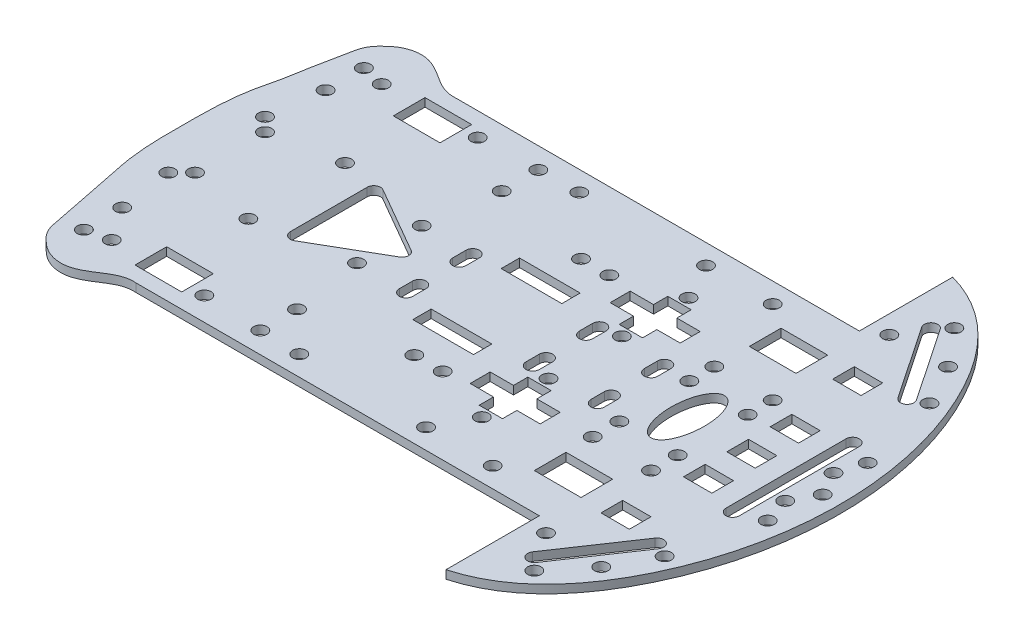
SolidWorks part; units mm, degrees
ref_plane "Front Plane" through (0, 0, 0) normal (0, 0, 1) x (1, 0, 0)
ref_plane "Top Plane" through (0, 0, 0) normal (0, 1, 0) x (1, 0, 0)
ref_plane "Right Plane" through (0, 0, 0) normal (1, 0, 0) x (0, 0, -1)
sketch "Sketch2" plane through (0, 0, 0) normal (0, 1, 0) x (1, 0, 0)
  line L0 (0, 0) -> (0, 28)
  line L1 (0, 0) -> (-121, 0)
  line L2 (0, 0) -> (0, -124) construction
  line L3 (0, -124) -> (0, -96)
  line L4 (14, 21) -> (14, -117) construction
  line L5 (32, -2.5) -> (32, -93.5) construction
  line L6 (0, -96) -> (-121, -96)
  line L7 (-254.3121, -48) -> (180.1863, -48) construction
  line L8 (0, 0) -> (-155, 0) construction
  line L9 (0, -96) -> (-122.5501, -96) construction
  line L10 (-155, 48.2014) -> (-155, -143.5437) construction
  line L11 (-148, -96) -> (-155, -96) construction
  spline S0 degree 3 poles (0, 28) (15.1894, 23.8115) (45.5362, -13.3174) (45.5362, -82.6826) (15.1894, -119.8115) (0, -124) knots 0 0 0 0 0.249322 0.750678 1 1 1 1
  spline S1 degree 3 poles (-121, 0) (-125.0399, -0.3556) (-129.1896, 3.3273) (-135.1577, 6.1602) (-139.4539, 6.1499) (-143.9567, 4.43) (-146.3978, 1.5367) (-148, 0) knots 0 0 0 0 0.360479 0.538086 0.637028 0.777922 1 1 1 1
  spline S2 degree 3 poles (-121, -96) (-125.0399, -95.6444) (-129.1896, -99.3273) (-135.1577, -102.1602) (-139.4539, -102.1499) (-143.9567, -100.43) (-146.3978, -97.5367) (-148, -96) knots 0 0 0 0 0.360479 0.538086 0.637028 0.777922 1 1 1 1
  spline S3 degree 3 poles (-148, 0) (-148.6873, -3.3293) (-149.6255, -8.3415) (-151.1154, -15.2359) (-151.7943, -20.3008) (-153.102, -25.2346) (-154.9359, -34.2214) (-155.0201, -47.9932) (-155.0126, -61.796) (-152.9783, -70.9972) (-152.0058, -76.0008) (-150.9985, -80.9998) (-149.6677, -87.6668) (-148.6662, -92.6666) (-148, -96) knots 0 0 0 0 0.104866 0.157299 0.217562 0.262212 0.314645 0.500024 0.685402 0.737835 0.790268 0.842701 0.895134 1 1 1 1
  point P18 (-126, 1)
  point P20 (-131, 4)
  point P23 (-136, 6)
  point P24 (-139, 6)
  point P25 (-143, 4.5)
  point P26 (-146, 2)
  point P28 (-148, 0)
  point P42 (-149, -91)
  point P43 (-150, -86)
  point P44 (-151, -81)
  point P45 (-152, -76)
  point P46 (-153, -71)
  point P47 (-154, -66)
  point P48 (-154, -30)
  point P49 (30.7503, -96)
  point P50 (-153, -25)
  point P51 (-152, -20)
  point P52 (-151, -15)
  point P53 (-150, -10)
  point P54 (-149, -5)
  dimension "D1" = 28
  dimension "D2" = 124
  dimension "D3" = 5
  dimension "D4" = 14
  dimension "D5" = 18
  dimension "D6" = 48
  dimension "D7" = 69
  dimension "D8" = 69
  dimension "D9" = 45.5
  dimension "D10" = 45.5
  dimension "D11" = 155
  dimension "D12" = 155
  dimension "D13" = 34
  dimension "D14" = 5
  dimension "D15" = 1
  dimension "D16" = 4
  dimension "D17" = 10
  dimension "D18" = 15
  dimension "D19" = 18
  dimension "D20" = 22
  dimension "D21" = 25
  dimension "D22" = 6
  dimension "D23" = 6
  dimension "D24" = 4.5
  dimension "D25" = 2
  dimension "D26" = 27
  dimension "D27" = 10
  dimension "D28" = 15
  dimension "D29" = 20
  dimension "D30" = 25
  dimension "D31" = 30
  dimension "D32" = 6
  dimension "D33" = 5
  dimension "D34" = 4
  dimension "D35" = 3
  dimension "D36" = 2
  dimension "D37" = 1
  dimension "D38" = 30.7503
extrude "Boss-Extrude1" add sketch "Sketch2" along normal blind 2.5
fillet "Fillet2" radius 9 2 edges at (-148, 1.25, 0) (-148, 1.25, 96)
sketch "Sketch3" plane through (0, 0, 0) normal (0, -1, 0) x (1, 0, 0)
  line L0 (-60.5, 96) -> (-60.5, 0) construction
  line L1 (-12.5, 85) -> (1.5, 85)
  line L2 (-12.5, 85) -> (-12.5, 75.5)
  line L3 (-12.5, 75.5) -> (1.5, 75.5)
  line L4 (1.5, 85) -> (1.5, 75.5)
  line L5 (-121, 96) -> (0, 96) construction
  line L6 (0, 0) -> (-121, 0) construction
  line L7 (-155, 48) -> (42.1522, 48) construction
  line L8 (0, 96) -> (0, 124) construction
  line L9 (10, 107.5) -> (24.8186, 85.5305) construction
  line L10 (8.5, 86) -> (17, 86)
  line L11 (8.5, 86) -> (8.5, 79.5)
  line L12 (8.5, 79.5) -> (17, 79.5)
  line L13 (17, 86) -> (17, 79.5)
  line L14 (11.6581, 108.6184) -> (26.4767, 86.6489)
  line L15 (8.3419, 106.3816) -> (23.1605, 84.4121)
  line L17 (17.4093, 96.5153) -> (35.1318, 108.4692) construction
  line L18 (28, 30) -> (28, 66) construction
  line L19 (26, 30) -> (26, 66)
  line L20 (30, 30) -> (30, 66)
  line L21 (11.5, 51.25) -> (20, 51.25)
  line L22 (11.5, 51.25) -> (11.5, 44.75)
  line L23 (11.5, 44.75) -> (20, 44.75)
  line L24 (20, 51.25) -> (20, 44.75)
  line L25 (11.5, 64.25) -> (20, 64.25)
  line L26 (11.5, 64.25) -> (11.5, 57.75)
  line L27 (11.5, 57.75) -> (20, 57.75)
  line L28 (20, 64.25) -> (20, 57.75)
  line L29 (-34.25, 96) -> (-34.25, 48) construction
  line L30 (-40, 58) -> (-40, 54) construction
  line L31 (-38, 58) -> (-38, 54)
  line L32 (-42, 58) -> (-42, 54)
  line L33 (-20.5, 58) -> (-20.5, 54) construction
  line L34 (-18.5, 58) -> (-18.5, 54)
  line L35 (-22.5, 58) -> (-22.5, 54)
  line L36 (-78, 58) -> (-78, 54) construction
  line L37 (-76, 58) -> (-76, 54)
  line L38 (-80, 58) -> (-80, 54)
  line L39 (-37.75, 66) -> (-37.75, 61.7)
  line L40 (-69.95, 64) -> (-51.75, 64)
  line L41 (-69.95, 64) -> (-69.95, 58.5)
  line L42 (-69.95, 58.5) -> (-51.75, 58.5)
  line L43 (-51.75, 64) -> (-51.75, 58.5)
  line L44 (-44.75, 72) -> (-37.75, 72)
  line L45 (-44.75, 72) -> (-44.75, 66)
  line L46 (-44.75, 66) -> (-37.75, 66)
  line L47 (-23.75, 72) -> (-23.75, 66)
  line L48 (-37.75, 76.3) -> (-30.75, 76.3)
  line L49 (-37.75, 76.3) -> (-37.75, 72)
  line L50 (-37.75, 61.7) -> (-30.75, 61.7)
  line L51 (-30.75, 76.3) -> (-30.75, 72)
  line L52 (-30.75, 66) -> (-30.75, 61.7)
  line L53 (-30.75, 72) -> (-23.75, 72)
  line L54 (-30.75, 66) -> (-23.75, 66)
  line L55 (-142.6374, 90) -> (-142.6374, 60.8786) construction
  line L56 (-125.8, 91.5) -> (-111.8, 91.5)
  line L57 (-125.8, 91.5) -> (-125.8, 82)
  line L58 (-125.8, 82) -> (-111.8, 82)
  line L59 (-111.8, 91.5) -> (-111.8, 82)
  line L60 (-23.75, 24) -> (-23.75, 30)
  line L67 (-111.1799, 59.5359) -> (-111.1799, 36.4641)
  line L68 (-108.1799, 34.7321) -> (-88.1991, 46.2679)
  line L69 (-88.1991, 49.7321) -> (-108.1799, 61.2679)
  line L70 (10, -11.5) -> (24.8186, 10.4695) construction
  line L71 (11.6581, -12.6184) -> (26.4767, 9.3511)
  line L72 (8.3419, -10.3816) -> (23.1605, 11.5879)
  line L73 (8.5, 10) -> (17, 10)
  line L74 (8.5, 10) -> (8.5, 16.5)
  line L75 (17, 10) -> (17, 16.5)
  line L76 (8.5, 16.5) -> (17, 16.5)
  line L77 (11.5, 38.25) -> (20, 38.25)
  line L78 (20, 31.75) -> (20, 38.25)
  line L79 (11.5, 31.75) -> (20, 31.75)
  line L80 (11.5, 31.75) -> (11.5, 38.25)
  line L81 (-20.5, 38) -> (-20.5, 42) construction
  line L82 (-18.5, 38) -> (-18.5, 42)
  line L83 (-22.5, 38) -> (-22.5, 42)
  line L84 (1.5, 11) -> (1.5, 20.5)
  line L85 (-12.5, 20.5) -> (1.5, 20.5)
  line L86 (-12.5, 11) -> (-12.5, 20.5)
  line L87 (-12.5, 11) -> (1.5, 11)
  line L88 (-30.75, 24) -> (-23.75, 24)
  line L89 (-30.75, 19.7) -> (-30.75, 24)
  line L90 (-37.75, 19.7) -> (-30.75, 19.7)
  line L91 (-37.75, 19.7) -> (-37.75, 24)
  line L92 (-44.75, 24) -> (-37.75, 24)
  line L93 (-44.75, 24) -> (-44.75, 30)
  line L94 (-44.75, 30) -> (-37.75, 30)
  line L95 (-30.75, 30) -> (-23.75, 30)
  line L96 (-30.75, 30) -> (-30.75, 34.3)
  line L97 (-37.75, 34.3) -> (-30.75, 34.3)
  line L98 (-37.75, 30) -> (-37.75, 34.3)
  line L99 (-40, 38) -> (-40, 42) construction
  line L100 (-38, 38) -> (-38, 42)
  line L101 (-42, 38) -> (-42, 42)
  line L102 (-51.75, 32) -> (-51.75, 37.5)
  line L103 (-69.95, 32) -> (-51.75, 32)
  line L104 (-69.95, 32) -> (-69.95, 37.5)
  line L105 (-78, 38) -> (-78, 42) construction
  line L106 (-76, 38) -> (-76, 42)
  line L107 (-80, 38) -> (-80, 42)
  line L108 (-69.95, 37.5) -> (-51.75, 37.5)
  line L109 (-125.8, 4.5) -> (-111.8, 4.5)
  line L110 (-125.8, 4.5) -> (-125.8, 14)
  line L111 (-111.8, 4.5) -> (-111.8, 14)
  line L112 (-125.8, 14) -> (-111.8, 14)
  arc A0 (11.6581, 108.6184) -> (8.3419, 106.3816) centre (10, 107.5) ccw
  arc A1 (23.1605, 84.4121) -> (26.4767, 86.6489) centre (24.8186, 85.5305) ccw
  circle A2 centre (29.3099, 87.7279) radius 2
  circle A3 centre (22.5908, 100.0102) radius 2
  circle A4 centre (13.5, 111) radius 2
  circle A5 centre (5.5, 99.5) radius 2
  arc A6 (26, 30) -> (30, 30) centre (28, 30) ccw
  arc A7 (30, 66) -> (26, 66) centre (28, 66) ccw
  circle A8 centre (35.5, 63) radius 2
  circle A9 centre (33, 55.25) radius 2
  circle A10 centre (37, 48) radius 2
  circle A16 centre (-20, 90) radius 2
  circle A17 centre (-40, 90) radius 2
  circle A18 centre (-34.25, 79) radius 2
  circle A19 centre (-52, 73) radius 2
  circle A20 centre (-60.5, 73) radius 2
  circle A21 centre (-78, 90) radius 2
  circle A32 centre (-34.25, 59) radius 2
  circle A33 centre (5, 67.5) radius 2
  circle A34 centre (5, 59.5) radius 2
  circle A35 centre (-12.5, 67.5) radius 2
  circle A36 centre (-12.5, 59.5) radius 2
  arc A37 (-38, 58) -> (-42, 58) centre (-40, 58) ccw
  arc A38 (-42, 54) -> (-38, 54) centre (-40, 54) ccw
  arc A39 (-18.5, 58) -> (-22.5, 58) centre (-20.5, 58) ccw
  arc A40 (-22.5, 54) -> (-18.5, 54) centre (-20.5, 54) ccw
  arc A41 (-76, 58) -> (-80, 58) centre (-78, 58) ccw
  arc A42 (-80, 54) -> (-76, 54) centre (-78, 54) ccw
  circle A43 centre (-90, 89.7) radius 2
  circle A44 centre (-90, 78.7) radius 2
  circle A45 centre (-107.5, 89) radius 2
  circle A46 centre (-93, 57.7) radius 2
  circle A47 centre (-120.8, 62.5) radius 2
  circle A48 centre (-142.6374, 90) radius 2
  circle A49 centre (-135.8, 88.5) radius 2
  circle A50 centre (-142.6374, 78.5) radius 2
  circle A51 centre (-144.8, 62.5) radius 2
  circle A52 centre (-140.8, 58.5) radius 2
  circle A53 centre (-102.5196, 48) radius 8.6603 construction
  arc A54 (-88.1991, 46.2679) -> (-88.1991, 49.7321) centre (-89.1991, 48) ccw
  arc A55 (-111.1799, 36.4641) -> (-108.1799, 34.7321) centre (-109.1799, 36.4641) ccw
  arc A56 (-111.1799, 59.5359) -> (-108.1799, 61.2679) centre (-109.1799, 59.5359) cw
  arc A57 (11.6581, -12.6184) -> (8.3419, -10.3816) centre (10, -11.5) cw
  arc A58 (23.1605, 11.5879) -> (26.4767, 9.3511) centre (24.8186, 10.4695) cw
  circle A59 centre (5.5, -3.5) radius 2
  circle A60 centre (13.5, -15) radius 2
  circle A61 centre (22.5908, -4.0102) radius 2
  circle A62 centre (29.3099, 8.2721) radius 2
  circle A63 centre (33, 40.75) radius 2
  circle A64 centre (35.5, 33) radius 2
  circle A65 centre (4.9929, 31) radius 2
  circle A66 centre (4.9995, 38.5) radius 2
  arc A67 (-18.5, 38) -> (-22.5, 38) centre (-20.5, 38) cw
  arc A68 (-22.5, 42) -> (-18.5, 42) centre (-20.5, 42) cw
  circle A69 centre (-12.5004, 38.5) radius 2
  circle A70 centre (-12.5071, 31) radius 2
  circle A71 centre (-20, 6) radius 2
  circle A72 centre (-40, 6) radius 2
  circle A73 centre (-34.25, 17) radius 2
  circle A74 centre (-34.25, 37) radius 2
  arc A75 (-38, 38) -> (-42, 38) centre (-40, 38) cw
  arc A76 (-42, 42) -> (-38, 42) centre (-40, 42) cw
  circle A77 centre (-52, 23) radius 2
  circle A78 centre (-60.5, 23) radius 2
  arc A79 (-76, 38) -> (-80, 38) centre (-78, 38) cw
  arc A80 (-80, 42) -> (-76, 42) centre (-78, 42) cw
  circle A81 centre (-93, 38.3) radius 2
  circle A82 centre (-78, 6) radius 2
  circle A83 centre (-90, 6.3) radius 2
  circle A84 centre (-90, 17.3) radius 2
  circle A85 centre (-107.5, 7) radius 2
  circle A86 centre (-120.8, 33.5) radius 2
  circle A87 centre (-140.8, 37.5) radius 2
  circle A88 centre (-144.8, 33.5) radius 2
  circle A89 centre (-142.6374, 17.5) radius 2
  circle A90 centre (-135.8, 7.5) radius 2
  circle A91 centre (-142.6374, 6) radius 2
  ellipse E0 centre (-3.5, 48) end of major axis (-3.5, 59) minor radius 5
  spline S0 degree 3 poles (-148.5436, 2.6886) (-149.0282, 5.1259) (-149.8186, 9.2353) (-151.1154, 15.2359) (-151.7943, 20.3008) (-153.102, 25.2346) (-154.9359, 34.2214) (-155.0201, 47.9932) (-155.0126, 61.796) (-152.9783, 70.9972) (-152.0058, 76.0008) (-150.9985, 80.9998) (-149.8454, 86.7764) (-149.0227, 90.8859) (-148.5341, 93.3289) knots 0.028206 0.028206 0.028206 0.028206 0.104866 0.157299 0.217562 0.262212 0.314645 0.500024 0.685402 0.737835 0.790268 0.842701 0.895134 0.971989 0.971989 0.971989 0.971989 construction
  spline S1 degree 3 poles (0, 124) (15.1894, 119.8115) (45.5362, 82.6826) (45.5362, 13.3174) (15.1894, -23.8115) (0, -28) knots 0 0 0 0 0.249322 0.750678 1 1 1 1 construction
  point P24 (17.4093, 96.5153)
  point P37 (28, 48)
  point P64 (15.75, 51.25)
  point P87 (-40, 56)
  point P93 (11.5, 48)
  point P100 (-20.5, 56)
  point P107 (-78, 56)
  point P130 (-37.75, 74.15)
  point P134 (-34.25, 76.3)
  point P165 (-85.1991, 48)
  point P169 (-111.1799, 33)
  point P176 (17.4093, -0.5153)
  point P207 (-20.5, 40)
  point P240 (-40, 40)
  point P255 (-78, 40)
  dimension "D9" = 2
  dimension "D14" = 4
  dimension "D18" = 4
  dimension "D20" = 4
  dimension "D21" = 4
  dimension "D26" = 24.5
  dimension "D27" = 48
  dimension "D28" = 4
  dimension "D29" = 4
  dimension "D30" = 4
  dimension "D31" = 8.5
  dimension "D44" = 4
  dimension "D45" = 4
  dimension "D46" = 4
  dimension "D57" = 4
  dimension "D58" = 4
  dimension "D61" = 4
  dimension "D63" = 4
  dimension "D73" = 4
  dimension "D74" = 4
  dimension "D75" = 4
  dimension "D76" = 4
  dimension "D81" = 4
  dimension "D103" = 4
  dimension "D104" = 4
  dimension "D105" = 4
  dimension "D112" = 4
  dimension "D110" = 21
  dimension "D117" = 4.3
  dimension "D120" = 4
  dimension "D121" = 9
  dimension "D124" = 4
  dimension "D127" = 4
  dimension "D128" = 11.5
  dimension "D129" = 4
  dimension "D131" = 4
  dimension "D135" = 4
  dimension "D137" = 4.5
  dimension "D138" = 2
  dimension "D1" = 14
  dimension "D2" = 9.5
  dimension "D3" = 11
  dimension "D4" = 1.5
  dimension "D5" = 8.5
  dimension "D6" = 6.5
  dimension "D7" = 7
  dimension "D8" = 1
  dimension "D10" = 26.5
  dimension "D11" = 34
  dimension "D12" = 10
  dimension "D13" = 11.5
  dimension "D15" = 6.25
  dimension "D16" = 14
  dimension "D17" = 5
  dimension "D19" = 15
  dimension "D22" = 5.5
  dimension "D23" = 3.5
  dimension "D24" = 4
  dimension "D25" = 18
  dimension "D32" = 6.5
  dimension "D33" = 3.25
  dimension "D34" = 6
  dimension "D35" = 9
  dimension "D36" = 7.5
  dimension "D37" = 15
  dimension "D38" = 5
  dimension "D39" = 7.25
  dimension "D40" = 8.5
  dimension "D41" = 6.5
  dimension "D42" = 6.5
  dimension "D43" = 6
  dimension "D47" = 6
  dimension "D48" = 6
  dimension "D49" = 6
  dimension "D50" = 20
  dimension "D51" = 38
  dimension "D52" = 7.5
  dimension "D53" = 23
  dimension "D54" = 23
  dimension "D55" = 8.5
  dimension "D56" = 39.5
  dimension "D59" = 17
  dimension "D60" = 5.75
  dimension "D62" = 20
  dimension "D64" = 34.25
  dimension "D65" = 8
  dimension "D66" = 8
  dimension "D67" = 17.5
  dimension "D68" = 17.5
  dimension "D69" = 28.5
  dimension "D70" = 17.5
  dimension "D71" = 17.5
  dimension "D72" = 12.5
  dimension "D77" = 22
  dimension "D78" = 10
  dimension "D79" = 15
  dimension "D80" = 4
  dimension "D82" = 4
  dimension "D83" = 4
  dimension "D84" = 4
  dimension "D85" = 4
  dimension "D86" = 38
  dimension "D87" = 38
  dimension "D88" = 38
  dimension "D89" = 38
  dimension "D90" = 19.5
  dimension "D91" = 8
  dimension "D92" = 18.2
  dimension "D93" = 5.5
  dimension "D94" = 9
  dimension "D95" = 7
  dimension "D96" = 21
  dimension "D97" = 7
  dimension "D98" = 6
  dimension "D99" = 14.6
  dimension "D100" = 4.3
  dimension "D101" = 2.7
  dimension "D102" = 14
  dimension "D106" = 6.3
  dimension "D107" = 12
  dimension "D108" = 11
  dimension "D109" = 12
  dimension "D111" = 15
  dimension "D113" = 7
  dimension "D114" = 17.5
  dimension "D115" = 14
  dimension "D116" = 9.5
  dimension "D118" = 4.5
  dimension "D119" = 19.5
  dimension "D122" = 10
  dimension "D123" = 3
  dimension "D125" = 7
  dimension "D126" = 1.5
  dimension "D130" = 24
  dimension "D132" = 19.5
  dimension "D133" = 4
  dimension "D134" = 4
  dimension "D136" = 30
  dimension "D139" = 13.5
  dimension "D140" = 17.5
  dimension "D141" = 7.5
  dimension "D142" = 7.5
  dimension "D144" = 31
extrude "Cut-Extrude1" cut sketch "Sketch3" against normal through all
